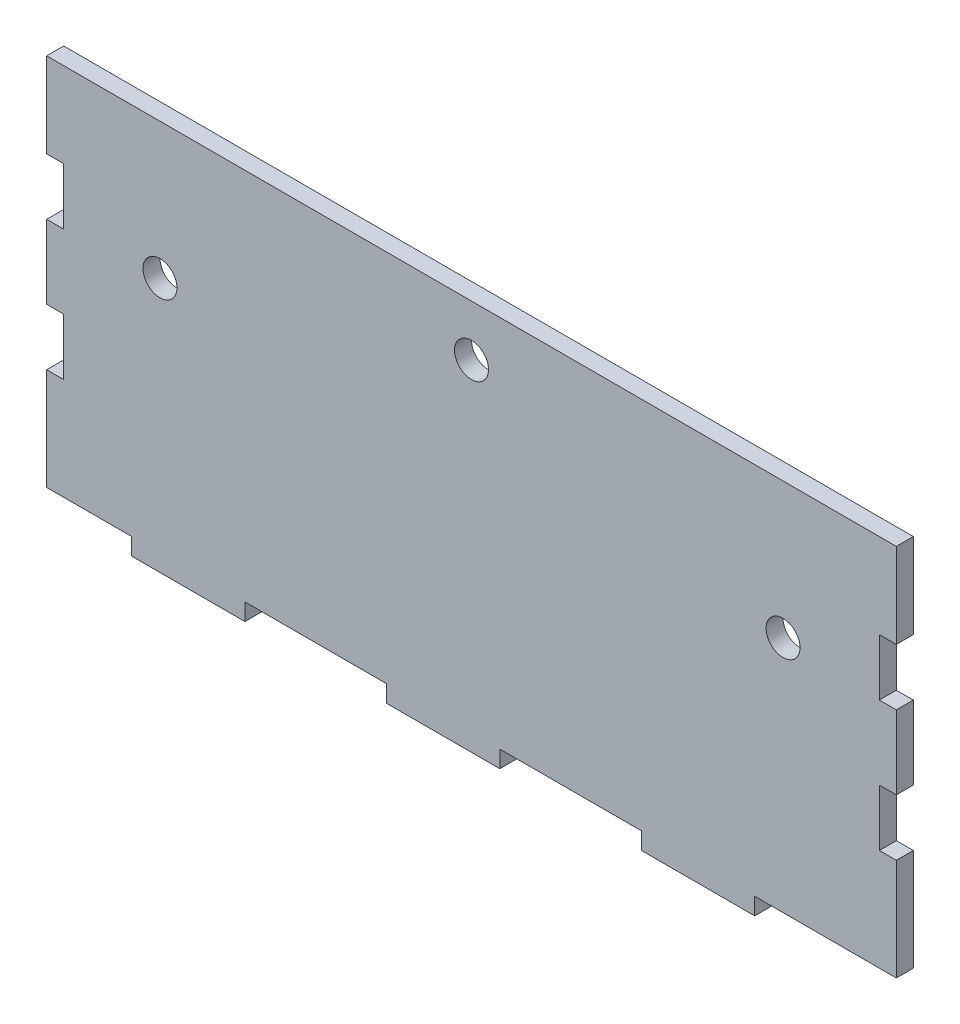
SolidWorks part; units mm, degrees
ref_plane "Alzado" through (0, 0, 0) normal (0, 0, 1) x (1, 0, 0)
ref_plane "Planta" through (0, 0, 0) normal (0, 1, 0) x (1, 0, 0)
ref_plane "Vista lateral" through (0, 0, 0) normal (1, 0, 0) x (0, 0, -1)
sketch "Croquis1" plane through (0, 0, 0) normal (0, 0, 1) x (1, 0, 0)
  line L1 (0, 0) -> (150, 0)
  line L2 (0, 0) -> (0, 75)
  line L3 (0, 75) -> (150, 75)
  line L4 (150, 0) -> (150, 75)
extrude "Saliente-Extruir1" add sketch "Croquis1" along normal blind 3
sketch "Croquis2" plane through (0, 0, 3) normal (0, 0, 1) x (1, 0, 0)
  line L15 (150, 69) -> (0, 69)
  line L71 (125, 3) -> (150, 3)
  line L75 (0, 75) -> (0, 0) construction
  line L80 (150, 0) -> (150, 75) construction
  line L81 (80, 3) -> (105, 3)
  line L82 (35, 3) -> (60, 3)
  line L83 (0, 3) -> (15, 3)
  line L84 (0, 0) -> (0, 3)
  line L85 (15, 0) -> (0, 0)
  line L86 (15, 3) -> (15, 0)
  line L87 (35, 0) -> (35, 3)
  line L88 (60, 0) -> (35, 0)
  line L89 (60, 3) -> (60, 0)
  line L90 (80, 0) -> (80, 3)
  line L91 (105, 0) -> (80, 0)
  line L92 (105, 3) -> (105, 0)
  line L93 (150, 3) -> (150, 0)
  line L94 (125, 0) -> (125, 3)
  line L95 (150, 0) -> (125, 0)
  line L96 (150, 54) -> (147, 54)
  line L97 (147, 54) -> (147, 44)
  line L98 (147, 44) -> (150, 44)
  line L99 (150, 44) -> (150, 54)
  line L100 (0, 21) -> (3, 21)
  line L101 (0, 44) -> (0, 54)
  line L102 (3, 44) -> (0, 44)
  line L103 (3, 54) -> (3, 44)
  line L104 (0, 54) -> (3, 54)
  line L105 (3, 21) -> (3, 31)
  line L106 (3, 31) -> (0, 31)
  line L107 (0, 31) -> (0, 21)
  line L108 (150, 31) -> (150, 21)
  line L109 (147, 31) -> (150, 31)
  line L110 (147, 21) -> (147, 31)
  line L111 (150, 21) -> (147, 21)
  line L123 (150, 69) -> (150, 75)
  line L124 (150, 75) -> (0, 75)
  line L125 (0, 75) -> (0, 69)
  circle A0 centre (75, 60) radius 3
  circle A1 centre (130, 45) radius 3
  circle A2 centre (20, 45) radius 3
extrude "Cortar-Extruir1" cut sketch "Croquis2" against normal blind 6
